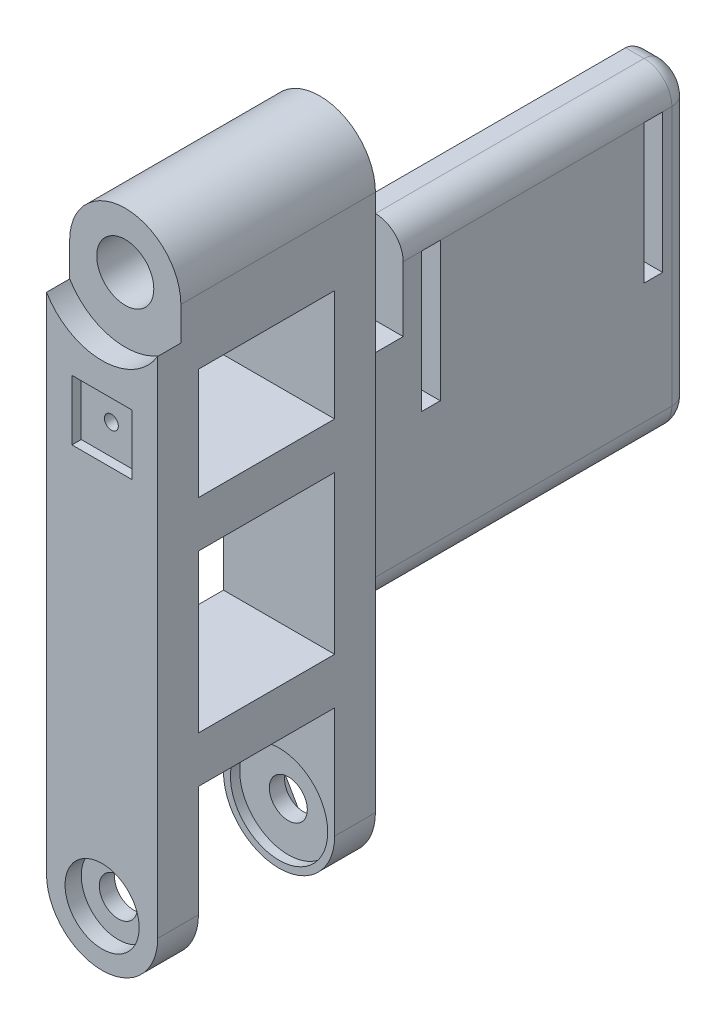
SolidWorks part; units mm, degrees
ref_plane "前视基准面" through (0, 0, 0) normal (0, 0, 1) x (1, 0, 0)
ref_plane "上视基准面" through (0, 0, 0) normal (0, 1, 0) x (1, 0, 0)
ref_plane "右视基准面" through (0, 0, 0) normal (1, 0, 0) x (0, 0, -1)
other "Configuration Table"
sketch "草图1" plane through (0, 0, 0) normal (0, 0, 1) x (1, 0, 0)
  line L2 (0, 0) -> (0, 58)
  line L4 (12, 0) -> (12, 58)
  arc A0 (0, 58) -> (12, 58) centre (6, 58) cw
  arc A1 (12, 0) -> (0, 0) centre (6, 0) cw
  circle A2 centre (6, 58) radius 3.08
  circle A3 centre (6, 0) radius 2.05
  dimension "D1" = 12
  dimension "D2" = 58
extrude "凸台-拉伸7" add sketch "草图1" against normal blind 25.5
sketch "草图6" plane through (12, 0, 0) normal (1, 0, 0) x (0, 0, -1)
  line L1 (5.4, -6) -> (20.1, -6)
  line L2 (5.4, -6) -> (5.4, 12)
  line L3 (5.4, 12) -> (20.1, 12)
  line L4 (20.1, -6) -> (20.1, 12)
  line L5 (0, 0) -> (0, -6) construction
  line L7 (5.4, 17) -> (20.1, 17)
  line L8 (5.4, 17) -> (5.4, 34)
  line L9 (5.4, 34) -> (20.1, 34)
  line L10 (20.1, 17) -> (20.1, 34)
  line L15 (5.4, 39) -> (20.1, 39)
  line L24 (5.4, 39) -> (5.4, 51)
  line L25 (5.4, 51) -> (20.1, 51)
  line L26 (20.1, 39) -> (20.1, 51)
  dimension "D6" = 12
  dimension "D1" = 14.7
  dimension "D2" = 5.4
  dimension "D3" = 5
  dimension "D4" = 5
  dimension "D5" = 17
extrude "切除-拉伸1" cut sketch "草图6" against normal blind 20
sketch "草图7" plane through (0, 0, 0) normal (0, 0, 1) x (1, 0, 0)
  circle A0 centre (6, 0) radius 3.15
extrude "切除-拉伸2" cut sketch "草图7" against normal blind 2.75
sketch "草图8" plane through (0, 0, -25.5) normal (0, 0, -1) x (-1, 0, 0)
  line L1 (-2.6514, 0) -> (-4.3257, 2.9)
  line L2 (-4.3257, 2.9) -> (-7.6743, 2.9)
  line L3 (-7.6743, 2.9) -> (-9.3486, 0)
  line L4 (-9.3486, 0) -> (-7.6743, -2.9)
  line L5 (-7.6743, -2.9) -> (-4.3257, -2.9)
  line L6 (-4.3257, -2.9) -> (-2.6514, 0)
  circle A0 centre (-6, 0) radius 2.9 construction
extrude "切除-拉伸3" cut sketch "草图8" against normal blind 2.75
sketch "草图9" plane through (0, 0, 0) normal (0, 0, 1) x (1, 0, 0)
  line L0 (6, 58) -> (6, 53) construction
  line L1 (6, 53) -> (6, 48) construction
  line L2 (6, 48) -> (6, 37.6649) construction
  line L3 (2.75, 48) -> (9.25, 48)
  line L4 (2.75, 48) -> (2.75, 41.5)
  line L5 (2.75, 41.5) -> (9.25, 41.5)
  line L6 (9.25, 48) -> (9.25, 41.5)
  point P8 (6, 48)
  dimension "D1" = 5
  dimension "D2" = 5
  dimension "D3" = 6.5
  dimension "D4" = 6.5
extrude "切除-拉伸4" cut sketch "草图9" against normal blind 2
sketch "草图11" plane through (0, 0, -2) normal (0, 0, 1) x (1, 0, 0)
  line L0 (6, 48) -> (6, 41.5) construction
  line L1 (9.25, 48) -> (2.75, 48) construction
  line L2 (2.75, 41.5) -> (9.25, 41.5) construction
  circle A0 centre (6, 44.75) radius 0.75
  dimension "D1" = 3.25
extrude "切除-拉伸5" cut sketch "草图11" against normal up to surface (3.4 mm away)
sketch "草图12" plane through (0, 0, -25.5) normal (0, 0, -1) x (-1, 0, 0)
  line L2 (0, 12) -> (0, 36)
  line L3 (0, 36) -> (-5, 36)
  line L4 (-5, 12) -> (-5, 36)
  line L5 (0, 58) -> (0, 0) construction
  line L6 (-5, 12) -> (0, 12)
  circle A0 centre (-6, 0) radius 2.05 construction
  point P11 (-2.5, 36)
  dimension "D1" = 0
  dimension "D2" = 5
  dimension "D3" = 24
  dimension "D4" = 12
extrude "凸台-拉伸8" add sketch "草图12" along normal blind 40
sketch "草图14" plane through (0, 0, -25.5) normal (0, 0, -1) x (-1, 0, 0)
  circle A0 centre (-6, 58) radius 7
sketch "草图15" plane through (0, 0, 0) normal (0, 0, 1) x (1, 0, 0)
  circle A0 centre (6, 58) radius 7
extrude "切除-拉伸8" cut sketch "草图15" against normal blind 3.5
sketch "草图16" plane through (0, 0, -25.5) normal (0, 0, -1) x (-1, 0, 0)
  line L0 (0, 54.3944) -> (0, 36)
  line L1 (0, 36) -> (-5, 36)
  line L2 (-5, 36) -> (-5, 12)
  line L3 (-5, 12) -> (0, 12)
  line L4 (0, 12) -> (0, 0)
  line L5 (-12, 54.3944) -> (-12, 0)
  arc A0 (-12, 54.3944) -> (0, 54.3944) centre (-6, 58) ccw
  arc A1 (-12, 0) -> (0, 0) centre (-6, 0) ccw
extrude "切除-拉伸9" cut sketch "草图16" against normal blind 1
sketch "草图17" plane through (0, 0, 0) normal (0, 0, 1) x (1, 0, 0)
  line L0 (12, 54.3944) -> (12, 0)
  line L1 (0, 54.3944) -> (0, 0)
  arc A0 (0, 54.3944) -> (12, 54.3944) centre (6, 58) ccw
  arc A1 (0, 0) -> (12, 0) centre (6, 0) ccw
extrude "切除-拉伸10" cut sketch "草图17" against normal blind 1
sketch "草图18" plane through (0, 0, -20.1) normal (0, 0, 1) x (1, 0, 0)
  circle A0 centre (6, 0) radius 5.25
extrude "切除-拉伸11" cut sketch "草图18" against normal blind 1
sketch "草图20" plane through (0, 0, -5.4) normal (0, 0, -1) x (-1, 0, 0)
  circle A0 centre (-5.8704, 0) radius 5.25
  circle A1 centre (-6, 0) radius 2.05 construction
  dimension "D1" = 0
extrude "切除-拉伸12" cut sketch "草图20" against normal blind 1
extrude "切除-拉伸15" cut sketch "草图14" against normal blind 1
sketch "草图21" plane through (0, 36, 0) normal (0, 1, 0) x (1, 0, 0)
  line L0 (5, 65.5) -> (5, 24.5) construction
  line L1 (0, 65.5) -> (5, 65.5)
  line L2 (0, 65.5) -> (0, 34.5)
  line L3 (0, 34.5) -> (5, 34.5)
  line L4 (5, 65.5) -> (5, 34.5)
  line L5 (5, 24.5) -> (0, 24.5) construction
  dimension "D1" = 10
extrude "凸台-拉伸9" add sketch "草图21" along normal blind 10
sketch "草图13" plane through (5, 0, 0) normal (1, 0, 0) x (0, 0, -1)
  line L1 (36.5, 43) -> (38.5, 43)
  line L2 (36.5, 43) -> (36.5, 28)
  line L3 (36.5, 28) -> (38.5, 28)
  line L4 (38.5, 43) -> (38.5, 28)
  line L6 (65.5, 46) -> (65.5, 12) construction
  line L7 (60.5, 43) -> (62.5, 43)
  line L8 (60.5, 43) -> (60.5, 28)
  line L9 (60.5, 28) -> (62.5, 28)
  line L10 (62.5, 43) -> (62.5, 28)
  line L11 (34.5, 46) -> (65.5, 46) construction
  dimension "D1" = 15
  dimension "D2" = 3
  dimension "D3" = 2
  dimension "D4" = 2
  dimension "D5" = 3
  dimension "D6" = 0
  dimension "D7" = 0
  dimension "D8" = 22
extrude "切除-拉伸6" cut sketch "草图13" against normal blind 30
fillet "圆角2" radius 3 2 edges at (5, 12, -45) (5, 46, -50)
fillet "圆角3" radius 2 6 edges at (1, 46, -65.5) (4.1213, 45.1213, -65.5) (1, 12, -65.5) (4.1213, 12.8787, -65.5) (5, 29, -65.5) (0, 29, -65.5)
sketch "草图22" plane through (0, 0, -1) normal (0, 0, 1) x (1, 0, 0)
  circle A0 centre (6, 0) radius 4
extrude "切除-拉伸16" cut sketch "草图22" against normal up to surface (1.75 mm away)
sketch "草图23" plane through (0, 0, -24.5) normal (0, 0, -1) x (-1, 0, 0)
  line L1 (-1.5, 0) -> (-3.75, 3.8971)
  line L2 (-3.75, 3.8971) -> (-8.25, 3.8971)
  line L3 (-8.25, 3.8971) -> (-10.5, 0)
  line L4 (-10.5, 0) -> (-8.25, -3.8971)
  line L5 (-8.25, -3.8971) -> (-3.75, -3.8971)
  line L6 (-3.75, -3.8971) -> (-1.5, 0)
  circle A0 centre (-6, 0) radius 3.8971 construction
  dimension "D1" = 4.5
extrude "切除-拉伸17" cut sketch "草图23" against normal up to surface (1.75 mm away)
